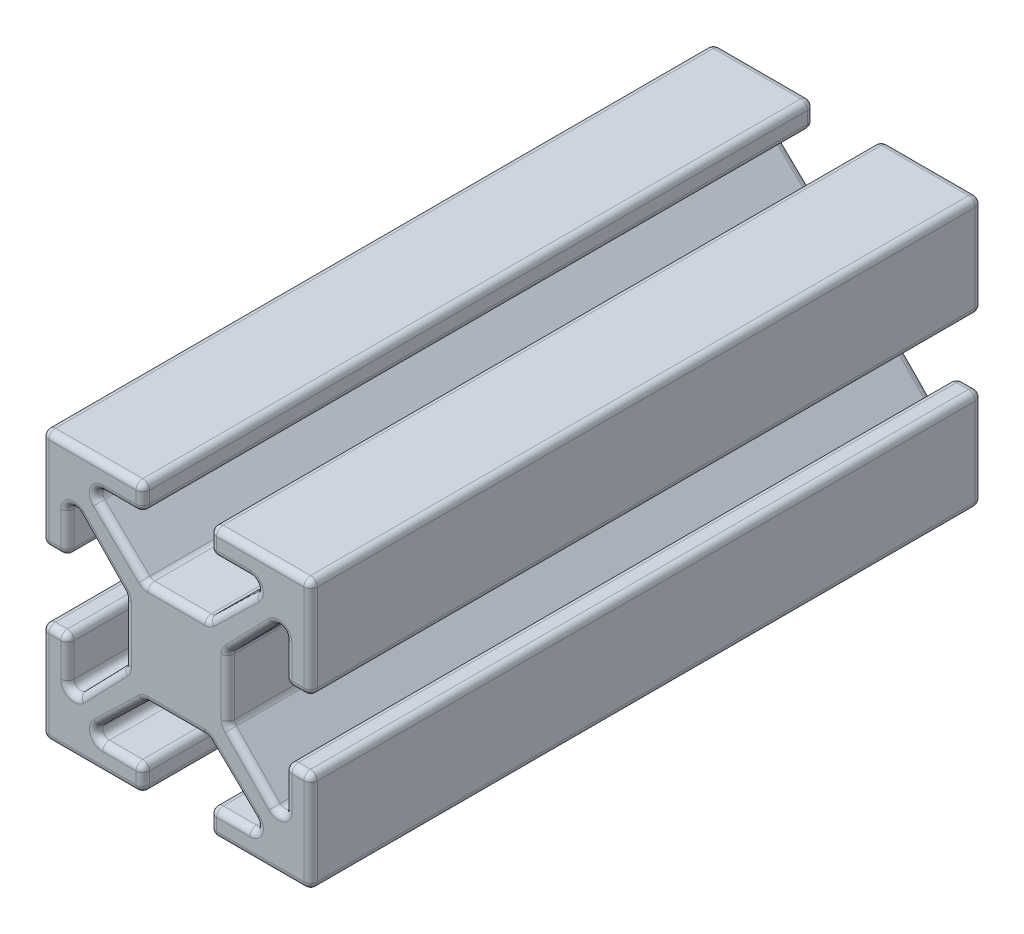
SolidWorks part; units mm, degrees
ref_plane "Front Plane" through (0, 0, 0) normal (0, 0, 1) x (1, 0, 0)
ref_plane "Top Plane" through (0, 0, 0) normal (0, 1, 0) x (1, 0, 0)
ref_plane "Right Plane" through (0, 0, 0) normal (1, 0, 0) x (0, 0, -1)
sketch "Sketch1" plane through (0, 0, 0) normal (0, 0, 1) x (1, 0, 0)
  line L0 (-5, 20) -> (-5, 16.2126)
  line L1 (-20, -20) -> (20, -20)
  line L2 (-20, -20) -> (-20, 20)
  line L3 (-20, 20) -> (20, 20)
  line L4 (20, -20) -> (20, 20)
  line L5 (-20, -20) -> (20, 20) construction
  line L6 (-20, 20) -> (20, -20) construction
  line L7 (-5, 16.2126) -> (-13.4323, 16.2126)
  line L8 (-13.4323, 16.2126) -> (-4.6312, 7.6894)
  line L9 (-4.6312, 7.6894) -> (0, 7.6894)
  line L10 (-7.6894, 4.6312) -> (-7.6894, 0)
  line L11 (-16.2126, 13.4323) -> (-7.6894, 4.6312)
  line L12 (-16.2126, 5) -> (-16.2126, 13.4323)
  line L13 (-20, 5) -> (-16.2126, 5)
  line L14 (0, 7.6894) -> (0, 16.8611) construction
  line L15 (0, 0) -> (-11.384, 0) construction
  line L16 (5, 20) -> (5, 16.2126)
  line L17 (5, 16.2126) -> (13.4323, 16.2126)
  line L18 (13.4323, 16.2126) -> (4.6312, 7.6894)
  line L19 (16.2126, 13.4323) -> (7.6894, 4.6312)
  line L20 (16.2126, 5) -> (16.2126, 13.4323)
  line L21 (20, 5) -> (16.2126, 5)
  line L22 (7.6894, 4.6312) -> (7.6894, 0)
  line L23 (4.6312, 7.6894) -> (0, 7.6894)
  line L24 (20, -5) -> (16.2126, -5)
  line L25 (16.2126, -5) -> (16.2126, -13.4323)
  line L26 (16.2126, -13.4323) -> (7.6894, -4.6312)
  line L27 (13.4323, -16.2126) -> (4.6312, -7.6894)
  line L28 (5, -16.2126) -> (13.4323, -16.2126)
  line L29 (5, -20) -> (5, -16.2126)
  line L30 (4.6312, -7.6894) -> (0, -7.6894)
  line L31 (7.6894, -4.6312) -> (7.6894, 0)
  line L32 (-5, -20) -> (-5, -16.2126)
  line L33 (-5, -16.2126) -> (-13.4323, -16.2126)
  line L34 (-13.4323, -16.2126) -> (-4.6312, -7.6894)
  line L35 (-16.2126, -13.4323) -> (-7.6894, -4.6312)
  line L36 (-16.2126, -5) -> (-16.2126, -13.4323)
  line L37 (-20, -5) -> (-16.2126, -5)
  line L38 (-7.6894, -4.6312) -> (-7.6894, 0)
  line L39 (-4.6312, -7.6894) -> (0, -7.6894)
  point P0 (0, 0)
  point P52 (0, 0)
  dimension "D1" = 40
  dimension "D2" = 40
  dimension "D4" = 15
  dimension "D3" = 4
extrude "Boss-Extrude1" add sketch "Sketch1" along normal blind 100 contours L34 L39 L30 L27 L28 L29 L1 L4 L24 L25 L26 L31 L22 L19 L20 L21 L3 L16 L17 L18 L23 L9 L8 L7 L0 L2 L13 L12 L11 L10 L38 L35 L36 L37 L32 L33
fillet "Fillet3" radius 1 108 edges at (-9.0317, -11.951, 0) (0, -7.6894, 0) (9.0317, -11.951, 0) (9.2161, -16.2126, 0) (5, -18.1063, 0) (12.5, -20, 0) (20, -12.5, 0) (18.1063, -5, 0) (16.2126, -9.2161, 0) (11.951, -9.0317, 0) (7.6894, 0, 0) (11.951, 9.0317, 0) (16.2126, 9.2161, 0) (18.1063, 5, 0) (20, 12.5, 0) (5, 18.1063, 0) (9.2161, 16.2126, 0) (9.0317, 11.951, 0) (0, 7.6894, 0) (-9.0317, 11.951, 0) (-9.2161, 16.2126, 0) (-5, 18.1063, 0) (-12.5, 20, 0) (-20, 12.5, 0) (-18.1063, 5, 0) (-16.2126, 9.2161, 0) (-11.951, 9.0317, 0) (-7.6894, 0, 0) (-11.951, -9.0317, 0) (-16.2126, -9.2161, 0) (-18.1063, -5, 0) (-20, -12.5, 0) (-12.5, -20, 0) (-5, -18.1063, 0) (-9.2161, -16.2126, 0) (-9.0317, -11.951, 100) (0, -7.6894, 100) (9.0317, -11.951, 100) (9.2161, -16.2126, 100) (5, -18.1063, 100) (12.5, -20, 100) (20, -12.5, 100) (18.1063, -5, 100) (16.2126, -9.2161, 100) (11.951, -9.0317, 100) (7.6894, 0, 100) (11.951, 9.0317, 100) (16.2126, 9.2161, 100) (18.1063, 5, 100) (20, 12.5, 100) (12.5, 20, 100) (5, 18.1063, 100) (9.2161, 16.2126, 100) (9.0317, 11.951, 100) (0, 7.6894, 100) (-9.0317, 11.951, 100) (-9.2161, 16.2126, 100) (-5, 18.1063, 100) (-12.5, 20, 100) (-20, 12.5, 100) (-18.1063, 5, 100) (-16.2126, 9.2161, 100) (-11.951, 9.0317, 100) (-7.6894, 0, 100) (-11.951, -9.0317, 100) (-16.2126, -9.2161, 100) (-18.1063, -5, 100) (-20, -12.5, 100) (-12.5, -20, 100) (-5, -18.1063, 100) (-9.2161, -16.2126, 100) (-13.4323, -16.2126, 50) (-5, -16.2126, 50) (-5, -20, 50) (-20, -20, 50) (-20, -5, 50) (-16.2126, -5, 50) (-16.2126, -13.4323, 50) (-7.6894, -4.6312, 50) (-7.6894, 4.6312, 50) (-16.2126, 13.4323, 50) (-16.2126, 5, 50) (-20, 5, 50) (-20, 20, 50) (-5, 20, 50) (-5, 16.2126, 50) (-13.4323, 16.2126, 50) (-4.6312, 7.6894, 50) (4.6312, 7.6894, 50) (13.4323, 16.2126, 50) (5, 16.2126, 50) (5, 20, 50) (20, 20, 50) (20, 5, 50) (16.2126, 5, 50) (16.2126, 13.4323, 50) (7.6894, 4.6312, 50) (7.6894, -4.6312, 50) (16.2126, -13.4323, 50) (16.2126, -5, 50) (20, -5, 50) (20, -20, 50) (5, -20, 50) (5, -16.2126, 50) (13.4323, -16.2126, 50) (4.6312, -7.6894, 50) (-4.6312, -7.6894, 50) (12.5, 20, 0)
ref_plane "Plane1" through (0, 0, 50) normal (0, 0, 1) x (1, 0, 0)
